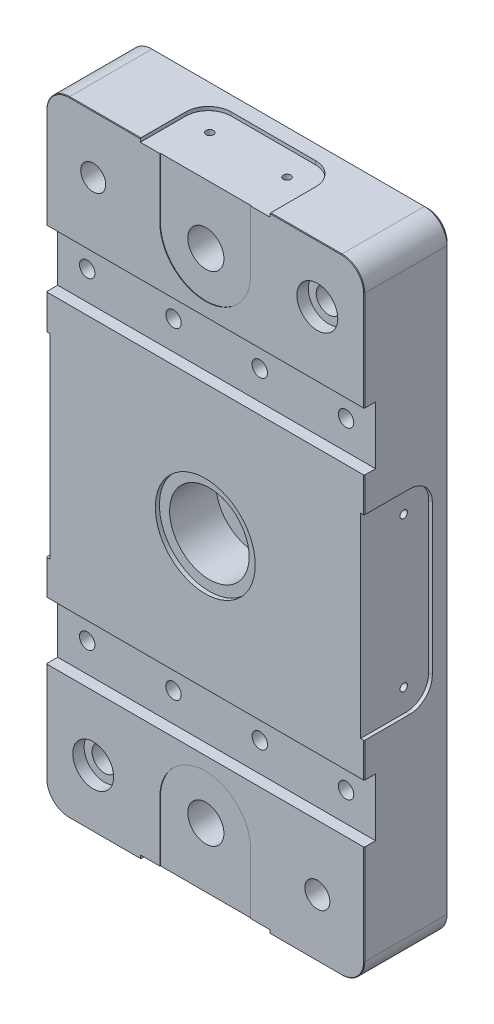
SolidWorks part; units mm, degrees
ref_plane "Front Plane" through (0, 0, 0) normal (0, 0, 1) x (1, 0, 0)
ref_plane "Top Plane" through (0, 0, 0) normal (0, 1, 0) x (1, 0, 0)
ref_plane "Right Plane" through (0, 0, 0) normal (1, 0, 0) x (0, 0, -1)
sketch "Sketch1" plane through (0, 0, 0) normal (0, 0, 1) x (1, 0, 0)
  line L1 (-60, 137.5) -> (60, 137.5)
  line L2 (-70, 127.5) -> (-70, -127.5)
  line L3 (-60, -137.5) -> (60, -137.5)
  line L4 (70, 127.5) -> (70, -127.5)
  line L5 (-70, 137.5) -> (70, -137.5) construction
  line L6 (-70, -137.5) -> (70, 137.5) construction
  arc A0 (-60, 137.5) -> (-70, 127.5) centre (-60, 127.5) ccw
  arc A1 (70, 127.5) -> (60, 137.5) centre (60, 127.5) ccw
  arc A2 (60, -137.5) -> (70, -127.5) centre (60, -127.5) ccw
  arc A3 (-70, -127.5) -> (-60, -137.5) centre (-60, -127.5) ccw
  point P0 (0, 0)
  dimension "D3" = 10
  dimension "D1" = 140
  dimension "D2" = 275
extrude "Extrude1" add sketch "Sketch1" along normal blind 38
sketch "Sketch2" plane through (0, 0, 38) normal (0, 0, 1) x (1, 0, 0)
  circle A0 centre (0, 0) radius 22
  dimension "D1" = 44
extrude "Extrude2" cut sketch "Sketch2" against normal blind 1.8
sketch "Sketch3" plane through (0, 0, 38) normal (0, 0, 1) x (1, 0, 0)
  line L0 (-85.9067, 0) -> (80.4153, 0) construction
  line L1 (-70, 127.5) -> (-70, -127.5) construction
  line L2 (-70, 83.7) -> (-70, 58.2)
  line L3 (70, -127.5) -> (70, 127.5) construction
  line L4 (70, -83.7) -> (70, -58.2)
  line L5 (-70, -58.2) -> (70, -58.2)
  line L6 (-70, 58.2) -> (70, 58.2)
  line L7 (-70, 83.7) -> (70, 83.7)
  line L8 (-70, -83.7) -> (70, -83.7)
  line L9 (-85.9067, 83.7) -> (80.4153, 83.7) construction
  line L10 (-85.9067, -83.7) -> (80.4153, -83.7) construction
  line L11 (-85.9067, 58.2) -> (80.4153, 58.2) construction
  line L12 (-85.9067, -58.2) -> (80.4153, -58.2) construction
  line L13 (70, 58.2) -> (70, 83.7)
  line L14 (-70, -58.2) -> (-70, -83.7)
  dimension "D1" = 58.2
  dimension "D2" = 58.2
  dimension "D3" = 25.5
  dimension "D4" = 25.5
extrude "Extrude3" cut sketch "Sketch3" against normal blind 5
chamfer "Chamfer1" distance 1.5 angle 45 8 edges at (-70, 0, 0) (-67.0711, -134.5711, 0) (-67.0711, 134.5711, 0) (0, -137.5, 0) (0, 137.5, 0) (67.0711, -134.5711, 0) (67.0711, 134.5711, 0) (70, 0, 0)
sketch "Sketch5" plane through (0, 0, 38) normal (0, 0, 1) x (1, 0, 0)
  circle A0 centre (0, 0) radius 17.5125
  dimension "D1" = 35.025
extrude "Extrude4" cut sketch "Sketch5" against normal blind 22.2
sketch "Sketch6" plane through (0, 0, 38) normal (0, 0, 1) x (1, 0, 0)
  line L0 (0, 0) -> (0, 146.8387) construction
  line L1 (0, 0) -> (94.6867, 0) construction
  circle A0 centre (0, 109.6) radius 7.95
  circle A1 centre (0, -109.6) radius 7.95
  dimension "D1" = 15.9
  dimension "D2" = 109.6
extrude "Extrude5" cut sketch "Sketch6" against normal blind 26
sketch "Sketch7" plane through (0, 0, 12) normal (0, 0, 1) x (1, 0, 0)
  circle A1 centre (0, 109.6) radius 7.95
  circle A2 centre (0, 109.6) radius 7.95
  circle A3 centre (0, -109.6) radius 7.95
  circle A4 centre (0, -109.6) radius 7.95
  dimension "D1" = 0
  dimension "D2" = 0
extrude "Extrude6" cut sketch "Sketch7" against normal through all draft 60
sketch "Sketch8" plane through (-70, 0, 0) normal (-1, 0, 0) x (0, 0, 1)
  line L1 (18, 43) -> (38, 43)
  line L3 (18, -43) -> (38, -43)
  line L4 (38, 58.2) -> (38, -58.2) construction
  line L5 (38, 43) -> (38, -43)
  line L6 (8, 33) -> (8, -33)
  line L7 (8, 58.2) -> (8, -58.2) construction
  line L8 (38, 58.2) -> (38, -58.2) construction
  arc A0 (8, -33) -> (18, -43) centre (18, -33) ccw
  arc A1 (18, 43) -> (8, 33) centre (18, 33) ccw
  dimension "D2" = 43
  dimension "D4" = 10
  dimension "D3" = 43
  dimension "D1" = 30
extrude "Cut-Extrude1" cut sketch "Sketch8" against normal blind 1.6
mirror "Mirror1" about plane through (0, 0, 0) normal (1, 0, 0) of "Cut-Extrude1"
sketch "Sketch9" plane through (0, 137.5, 0) normal (0, 1, 0) x (1, 0, 0)
  line L1 (28.6, -18) -> (28.6, -38)
  line L3 (-28.6, -18) -> (-28.6, -38)
  line L5 (60, -8) -> (-60, -8)
  line L6 (18.6, -8) -> (-18.6, -8)
  line L7 (60, -38) -> (-60, -38) construction
  line L10 (28.6, -38) -> (-28.6, -38)
  arc A0 (-18.6, -8) -> (-28.6, -18) centre (-18.6, -18) ccw
  arc A1 (18.6, -8) -> (28.6, -18) centre (18.6, -18) cw
  dimension "D4" = 10
  dimension "D1" = 28.6
  dimension "D3" = 28.6
  dimension "D2" = 30
extrude "Cut-Extrude2" cut sketch "Sketch9" against normal blind 1.6
mirror "Mirror2" about plane through (0, 0, 0) normal (0, 1, 0) of "Cut-Extrude2"
sketch "Sketch11" plane through (0, 0, 0) normal (0, 0, -1) x (-1, 0, 0)
  circle A0 centre (-49.36, 112.1) radius 5.5
  circle A1 centre (49.36, 112.1) radius 5.5
  circle A2 centre (49.36, -112.1) radius 5.5
  circle A3 centre (-49.36, -112.1) radius 5.5
  dimension "D1" = 11
  dimension "D2" = 112.1
  dimension "D3" = 49.36
  dimension "D4" = 49.36
  dimension "D5" = 112.1
extrude "Extrude7" cut sketch "Sketch11" against normal through all
sketch "Sketch12" plane through (0, 0, 0) normal (0, 0, -1) x (-1, 0, 0)
  circle A0 centre (-49.36, 112.1) radius 8.5
  circle A1 centre (49.36, 112.1) radius 8.5
  circle A2 centre (49.36, -112.1) radius 8.5
  circle A3 centre (-49.36, -112.1) radius 8.5
  dimension "D1" = 17
extrude "Extrude8" cut sketch "Sketch12" against normal blind 10.8
sketch "Sketch13" plane through (0, 0, 38) normal (0, 0, 1) x (1, 0, 0)
  circle A0 centre (49.36, 112.1) radius 9
  circle A1 centre (-49.36, -112.1) radius 9
  dimension "D1" = 18
extrude "Extrude9" cut sketch "Sketch13" against normal blind 5
sketch "Sketch14" plane through (0, 0, 33) normal (0, 0, 1) x (1, 0, 0)
  line L0 (0, 0) -> (0, 216.1599) construction
  line L1 (0, 0) -> (-153.4403, 0) construction
  circle A0 centre (-57, 70.9) radius 3.4
  circle A1 centre (-19, 70.9) radius 3.4
  circle A2 centre (-57, -70.9) radius 3.4
  circle A3 centre (-19, -70.9) radius 3.4
  circle A4 centre (19, -70.9) radius 3.4
  circle A5 centre (57, -70.9) radius 3.4
  circle A6 centre (57, 70.9) radius 3.4
  circle A7 centre (19, 70.9) radius 3.4
  dimension "D1" = 6.8
  dimension "D2" = 57
  dimension "D3" = 19
  dimension "D4" = 70.9
extrude "Extrude10" cut sketch "Sketch14" against normal blind 15
sketch "Sketch15" plane through (0, 0, 18) normal (0, 0, 1) x (1, 0, 0)
  circle A1 centre (-57, 70.9) radius 3.4
  circle A2 centre (-57, 70.9) radius 3.4
  circle A3 centre (-19, 70.9) radius 3.4
  circle A4 centre (-19, 70.9) radius 3.4
  circle A5 centre (19, 70.9) radius 3.4
  circle A6 centre (19, 70.9) radius 3.4
  circle A7 centre (57, 70.9) radius 3.4
  circle A8 centre (57, 70.9) radius 3.4
  circle A9 centre (-57, -70.9) radius 3.4
  circle A10 centre (-57, -70.9) radius 3.4
  circle A11 centre (-19, -70.9) radius 3.4
  circle A12 centre (-19, -70.9) radius 3.4
  circle A13 centre (19, -70.9) radius 3.4
  circle A14 centre (19, -70.9) radius 3.4
  circle A15 centre (57, -70.9) radius 3.4
  circle A16 centre (57, -70.9) radius 3.4
  dimension "D1" = 0
  dimension "D2" = 0
  dimension "D3" = 0
  dimension "D4" = 0
  dimension "D5" = 0
  dimension "D6" = 0
  dimension "D7" = 0
  dimension "D8" = 0
extrude "Extrude11" cut sketch "Sketch15" against normal through all draft 60
sketch "Sketch19" plane through (0, 135.9, 0) normal (0, 1, 0) x (1, 0, 0)
  line L0 (-60, 0) -> (60, 0) construction
  line L1 (18.6, -8) -> (-18.6, -8) construction
  circle A0 centre (-17, -19) radius 1.65
  circle A1 centre (17, -19) radius 1.65
  point P8 (0, 0)
  dimension "D1" = 3.3
  dimension "D2" = 11
  dimension "D3" = 17
  dimension "D4" = 17
extrude "Cut-Extrude6" cut sketch "Sketch19" against normal blind 8
sketch "Sketch20" plane through (0, 127.9, 0) normal (0, 1, 0) x (1, 0, 0)
  circle A1 centre (-17, -19) radius 1.65
  circle A2 centre (-17, -19) radius 1.65
  circle A3 centre (17, -19) radius 1.65
  circle A4 centre (17, -19) radius 1.65
  dimension "D1" = 0
  dimension "D2" = 0
extrude "Cut-Extrude7" cut sketch "Sketch20" against normal through all draft 60
mirror "Mirror4" about plane through (0, 0, 0) normal (0, 1, 0) of "Cut-Extrude6", "Cut-Extrude7"
sketch "Sketch23" plane through (68.4, 0, 0) normal (1, 0, 0) x (0, 0, -1)
  line L0 (0, 127.5) -> (0, -127.5) construction
  circle A0 centre (-19, 33) radius 1.65
  circle A1 centre (-19, -33) radius 1.65
  dimension "D1" = 3.3
  dimension "D4" = 33
  dimension "D2" = 33
  dimension "D3" = 19
extrude "Cut-Extrude10" cut sketch "Sketch23" against normal blind 8
sketch "Sketch24" plane through (60.4, 0, 0) normal (1, 0, 0) x (0, 0, -1)
  circle A0 centre (-19, 33) radius 1.65 construction
  circle A1 centre (-19, -33) radius 1.65
  circle A2 centre (-19, -33) radius 1.65
  circle A3 centre (-19, 33) radius 1.65
  dimension "D1" = 0
extrude "Cut-Extrude11" cut sketch "Sketch24" against normal through all draft 60
mirror "Mirror5" about plane through (0, 0, 0) normal (1, 0, 0) of "Cut-Extrude11", "Cut-Extrude10"
sketch "Sketch26" plane through (0, 0, 38) normal (0, 0, 1) x (1, 0, 0)
  line L0 (-28.6, 135.9) -> (28.6, 135.9) construction
  line L1 (-20, 135.9) -> (20, 135.9)
  line L2 (20, 109.6) -> (20, 135.9)
  line L3 (-20, 109.6) -> (-20, 135.9)
  arc A1 (-20, 109.6) -> (20, 109.6) centre (0, 109.6) ccw
  dimension "D1" = 20
extrude "Cut-Extrude13" cut sketch "Sketch26" against normal blind 0.25
mirror "Mirror6" about plane through (0, 0, 0) normal (0, 1, 0) of "Cut-Extrude13"
chamfer "Chamfer3" distance 0.25 angle 45 16 edges at (44.3, -137.5, 38) (67.0711, -134.5711, 38) (70, -105.6, 38) (70, -50.6, 38) (70, 105.6, 38) (70, 50.6, 38) (67.0711, 134.5711, 38) (44.3, 137.5, 38) (-44.3, -137.5, 38) (-67.0711, -134.5711, 38) (-70, -105.6, 38) (-70, 50.6, 38) (-70, 105.6, 38) (-70, -50.6, 38) (-44.3, 137.5, 38) (-67.0711, 134.5711, 38)
